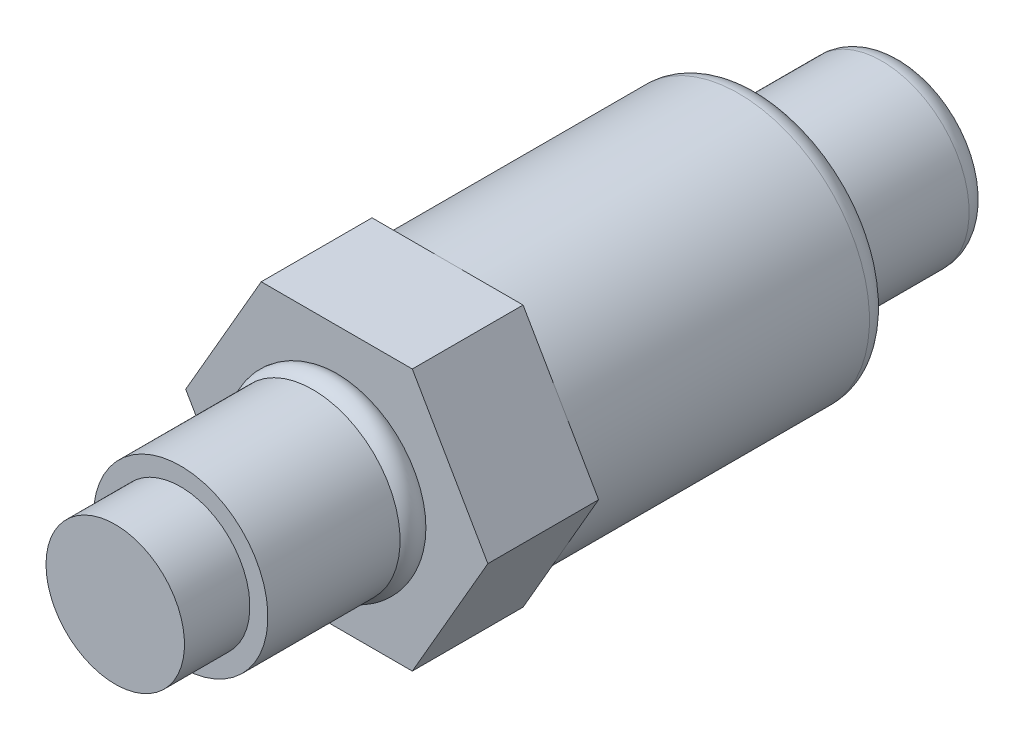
SolidWorks part; units mm, degrees
ref_plane "Front Plane" through (0, 0, 0) normal (0, 0, 1) x (1, 0, 0)
ref_plane "Top Plane" through (0, 0, 0) normal (0, 1, 0) x (1, 0, 0)
ref_plane "Right Plane" through (0, 0, 0) normal (1, 0, 0) x (0, 0, -1)
ref_plane "Plane1" through (0, 0, 19.43) normal (0, 0, 1) x (1, 0, 0)
sketch "Sketch1" plane through (0, 0, 19.43) normal (0, 0, 1) x (1, 0, 0)
  line L0 (6.9282, 0) -> (3.4641, 6)
  line L1 (3.4641, 6) -> (-3.4641, 6)
  line L2 (-3.4641, 6) -> (-6.9282, 0)
  line L3 (-6.9282, 0) -> (-3.4641, -6)
  line L4 (-3.4641, -6) -> (3.4641, -6)
  line L5 (3.4641, -6) -> (6.9282, 0)
extrude "Boss-Extrude1" add sketch "Sketch1" against normal blind 5.08
ref_plane "Plane2" through (0, 0, 0) normal (0, -1, 0) x (1, 0, 0)
sketch "Sketch2" plane through (0, 0, 0) normal (0, -1, 0) x (1, 0, 0)
  line L0 (6, 14.35) -> (0, 14.35)
  line L1 (0, 14.35) -> (0, -6.57)
  line L2 (0, -6.57) -> (4, -6.57)
  line L3 (4, -6.57) -> (4, 0)
  line L4 (4, 0) -> (6, 0)
  line L5 (6, 0) -> (6, 14.35)
  line L6 (0, 14.35) -> (0, -6.57) construction
revolve "Revolve1" add sketch "Sketch2" angle 360 about L6
sketch "Sketch3" plane through (0, 0, 0) normal (0, -1, 0) x (1, 0, 0)
  line L0 (3.175, 29.59) -> (0, 29.59)
  line L1 (0, 29.59) -> (0, 19.43)
  line L2 (0, 19.43) -> (4.0886, 19.43)
  line L3 (4, 20.5268) -> (4, 26.59)
  line L4 (4, 26.59) -> (3.175, 26.59)
  line L5 (3.175, 26.59) -> (3.175, 29.59)
  line L6 (0, 29.59) -> (0, 19.43) construction
  arc A0 (4.0886, 19.43) -> (4, 20.5268) centre (3.445, 19.93) ccw
revolve "Revolve2" add sketch "Sketch3" angle 360 about L6
fillet "Fillet1" radius 1 2 edges at (-6, 0, 0) (-4, 0, -6.57)
